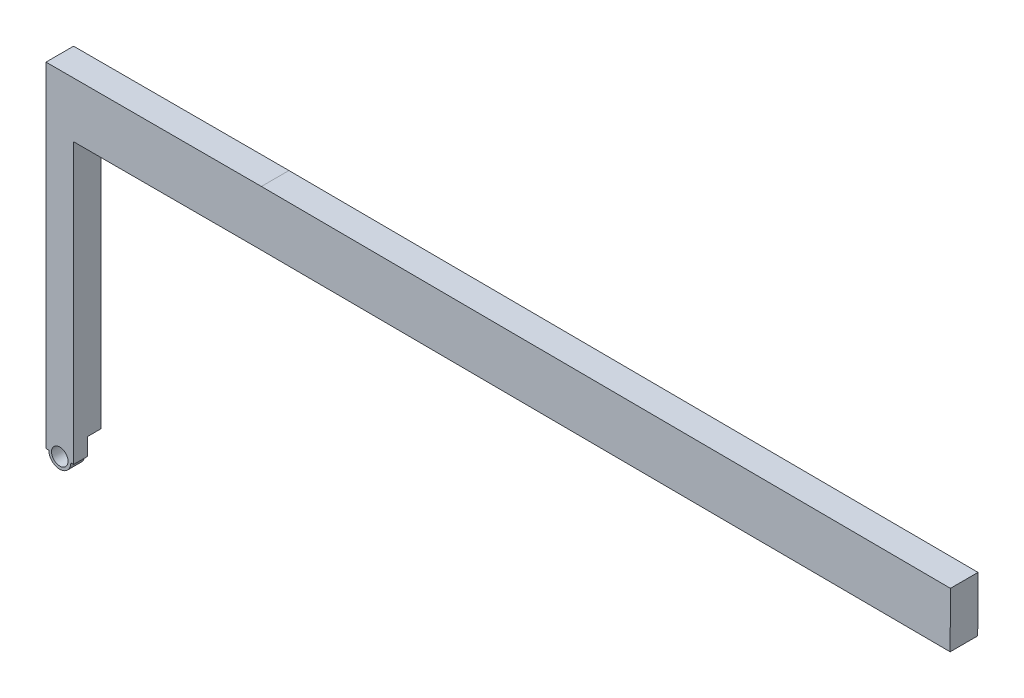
SolidWorks part; units mm, degrees
ref_plane "Front Plane" through (0, 0, 0) normal (0, 0, 1) x (1, 0, 0)
ref_plane "Top Plane" through (0, 0, 0) normal (0, 1, 0) x (1, 0, 0)
ref_plane "Right Plane" through (0, 0, 0) normal (1, 0, 0) x (0, 0, -1)
sketch "Sketch2" plane through (0, 0, 0) normal (0, 0, 1) x (1, 0, 0)
  line L0 (0, 0) -> (0, 13.3821)
  line L1 (0, 13.3821) -> (8.6425, 13.3821)
  spline S0 degree 3 poles (8.6425, 13.3821) (19.2175, 13.3282) (29.7925, 13.2743) (40.3675, 13.2204) knots 0 0 0 0 1 1 1 1
extrude "Extrude-Thin1" add sketch "Sketch2" along normal blind 1.27 thin
sketch "Sketch3" plane through (0, 0, 1.27) normal (0, 0, 1) x (1, 0, 0)
  line L0 (-1.27, 0) -> (-1.27, 15.9221)
  line L1 (0, 0) -> (-2.54, 0) construction
  line L2 (-2.54, 15.9221) -> (8.6489, 15.9221) construction
extrude "Extrude1" cut sketch "Sketch3" against normal through all and the other way through all
sketch "Sketch4" plane through (0, 0, 1.27) normal (0, 0, 1) x (1, 0, 0)
  circle A0 centre (-0.635, 0.508) radius 0.381
extrude "Extrude2" cut sketch "Sketch4" against normal through all
sketch "Sketch8" plane through (0, 0, 0) normal (1, 0, 0) x (0, 0, -1)
  line L0 (-0.635, 0) -> (-0.635, 1.016)
  line L1 (-1.27, 0) -> (0, 0) construction
  line L2 (-0.635, 1.016) -> (0, 1.016)
  line L4 (0, 0) -> (0, 13.3821) construction
extrude "Extrude6" cut sketch "Sketch8" against normal through all flip side to cut
sketch "Sketch12" plane through (0, 0, 0) normal (0, 0, -1) x (-1, 0, 0)
  circle A0 centre (0.635, 0.508) radius 1.016
extrude "Extrude10" cut sketch "Sketch12" against normal up to surface (0.635 mm away)
sketch "Sketch13" plane through (0, 0, 0.635) normal (0, 0, -1) x (-1, 0, 0)
  line L0 (0, 0) -> (1.27, 0) construction
  line L1 (0.127, 0.508) -> (0, 0.508)
  line L2 (0, 0) -> (0, 1.3011) construction
  line L3 (1.143, 0.508) -> (1.27, 0.508)
  line L4 (1.27, 0) -> (1.27, 1.3011) construction
  arc A0 (0.635, 0) -> (0.127, 0.508) centre (0.635, 0.508) cw
  arc A1 (0.635, 0) -> (1.143, 0.508) centre (0.635, 0.508) ccw
extrude "Extrude12" cut sketch "Sketch13" against normal through all and the other way through all flip side to cut
